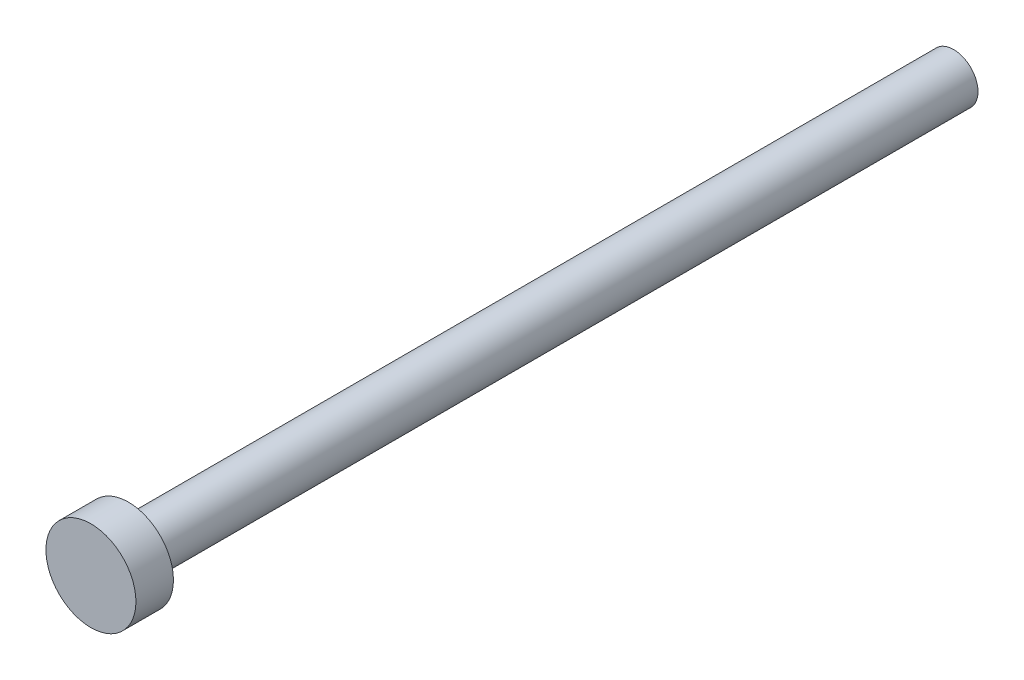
SolidWorks part; units mm, degrees
ref_plane "Plan de face" through (0, 0, 0) normal (0, 0, 1) x (1, 0, 0)
ref_plane "Plan de dessus" through (0, 0, 0) normal (0, 1, 0) x (1, 0, 0)
ref_plane "Plan de droite" through (0, 0, 0) normal (1, 0, 0) x (0, 0, -1)
sketch "Esquisse1" plane through (0, 0, 0) normal (0, 0, 1) x (1, 0, 0)
  circle A0 centre (0, 0) radius 6
  dimension "D1" = 12
extrude "Extrusion1" add sketch "Esquisse1" along normal blind 5
sketch "Esquisse3" plane through (0, 0, 0) normal (0, 0, -1) x (-1, 0, 0)
  circle A0 centre (0, 0) radius 3.25
  dimension "D1" = 6.5
extrude "Extrusion2" add sketch "Esquisse3" along normal blind 110
